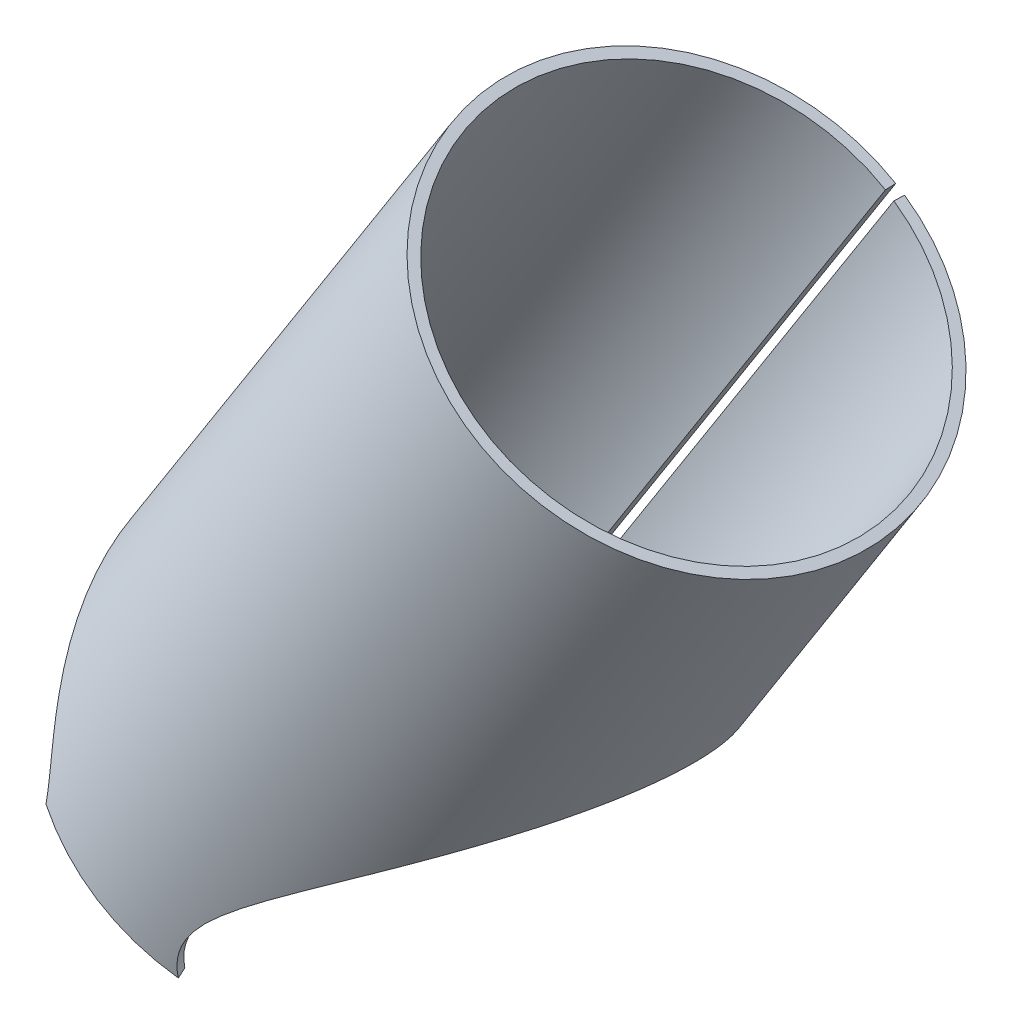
SolidWorks part; units mm, degrees
ref_plane "前视基准面" through (0, 0, 0) normal (0, 0, 1) x (1, 0, 0)
ref_plane "上视基准面" through (0, 0, 0) normal (0, 1, 0) x (1, 0, 0)
ref_plane "右视基准面" through (0, 0, 0) normal (1, 0, 0) x (0, 0, -1)
imported_body "基体零件-斜交三通管（包括垂直正交三通管）-1"
sheet metal parameters "钣金1" parameters "D1"=0.7366, "厚度"=1
bend "圆角折弯1" bend radius 19.3684 bend angle 357.187 parameters "D5"=1
flatten bends "展开-折弯1"
sketch "尖角-草图1" plane through (18.3209, 27.8206, -20.3622) normal (0.0207, -0.0132, -0.9997) x (-0.9998, -0.0003, -0.0207)
  line L0 (-33.0061, -60.5372) -> (-68.8122, -4.3636) construction
  dimension "D1" = 0
process bends "加工-折弯1" parameters "D1"=0
sketch "平面-草图1" plane through (18.3209, 27.8206, -20.3622) normal (0.0207, -0.0132, -0.9997) x (-0.9998, -0.0003, -0.0207)
